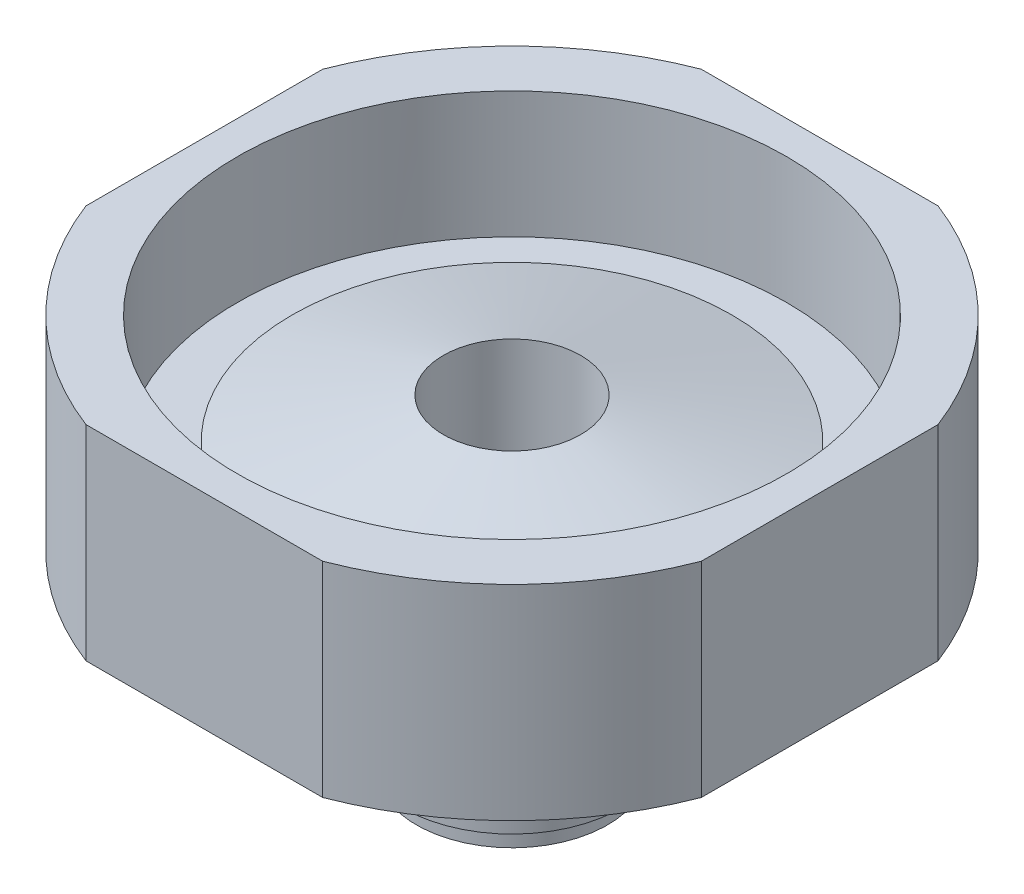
SolidWorks part; units mm, degrees
ref_plane "Front Plane" through (0, 0, 0) normal (0, 0, 1) x (1, 0, 0)
ref_plane "Top Plane" through (0, 0, 0) normal (0, 1, 0) x (1, 0, 0)
ref_plane "Right Plane" through (0, 0, 0) normal (1, 0, 0) x (0, 0, -1)
sketch "Sketch1" plane through (0, 0, 0) normal (0, 0, 1) x (1, 0, 0)
  line L0 (6.35, -2.2997) -> (6.35, -11.9517)
  line L1 (19.05, 0) -> (19.05, 9.525)
  line L2 (19.05, 9.525) -> (15.875, 9.525)
  line L3 (15.875, 9.525) -> (15.875, 5.5323)
  line L4 (3.9687, 5.5323) -> (3.9688, -1.0898)
  line L6 (11.684, 5.5323) -> (3.9687, 5.5323) construction
  line L8 (0, 0) -> (0, 12.4906) construction
  line L9 (6.35, -11.9517) -> (5.5245, -11.9517)
  line L10 (19.05, -2.2997) -> (19.05, 0)
  line L11 (15.875, 5.5323) -> (15.875, 2.342)
  line L12 (3.9687, 5.5323) -> (15.875, 2.342)
  line L13 (5.5245, -11.9517) -> (5.5245, -13.2217)
  line L14 (5.5245, -13.2217) -> (5.08, -13.2217)
  line L15 (5.08, -13.2217) -> (3.9688, -10.0467)
  line L16 (3.9688, -10.0467) -> (3.9688, -1.0898)
  line L17 (6.35, -2.2997) -> (19.05, -2.2997)
  dimension "D1" = 19.05
  dimension "D2" = 15.875
  dimension "D3" = 7.9375
  dimension "D4" = 11.684
  dimension "D5" = 15
  dimension "D6" = 2.342
  dimension "D7" = 3.175
  dimension "D8" = 12.7
  dimension "D9" = 11.049
  dimension "D10" = 10.16
  dimension "D11" = 1.27
  dimension "D12" = 2.2997
  dimension "D13" = 9.652
revolve "Revolve1" add sketch "Sketch1" angle 360 about L8
sketch "Sketch5" plane through (0, 9.525, 0) normal (0, 1, 0) x (1, 0, 0)
  circle A0 centre (0, 0) radius 15.875
  circle A1 centre (0, 0) radius 12.7
extrude "Cut-Extrude3" cut sketch "Sketch5" against normal blind 7.3025
sketch "Sketch6" plane through (0, 9.525, 0) normal (0, 1, 0) x (1, 0, 0)
  line L0 (0, 0) -> (17.78, 0) construction
  line L1 (17.78, 0) -> (17.78, 8.2083)
  line L2 (17.78, 0) -> (17.78, -6.8392)
  line L3 (17.78, -6.8392) -> (21.9145, -6.8392)
  line L4 (21.9145, -6.8392) -> (21.9145, 8.2083)
  line L5 (21.9145, 8.2083) -> (17.78, 8.2083)
  line L6 (0, 0) -> (0, 5.2183) construction
  line L7 (-21.9145, 8.2083) -> (-17.78, 8.2083)
  line L8 (-21.9145, -6.8392) -> (-21.9145, 8.2083)
  line L9 (-17.78, -6.8392) -> (-21.9145, -6.8392)
  line L10 (-17.78, 0) -> (-17.78, -6.8392)
  line L11 (-17.78, 0) -> (-17.78, 8.2083)
  line L12 (0, 0) -> (0, 17.78) construction
  line L13 (0, 17.78) -> (10.5138, 17.78)
  line L14 (10.5138, 17.78) -> (10.5138, 20.7692)
  line L15 (10.5138, 20.7692) -> (-9.1623, 20.7692)
  line L16 (-9.1623, 20.7692) -> (-9.1623, 17.78)
  line L17 (-9.1623, 17.78) -> (0, 17.78)
  line L18 (-9.1623, -17.78) -> (0, -17.78)
  line L19 (-9.1623, -20.7692) -> (-9.1623, -17.78)
  line L20 (10.5138, -20.7692) -> (-9.1623, -20.7692)
  line L21 (10.5138, -17.78) -> (10.5138, -20.7692)
  line L22 (0, -17.78) -> (10.5138, -17.78)
  circle A0 centre (0, 0) radius 19.05 construction
extrude "Cut-Extrude4" cut sketch "Sketch6" against normal through all
